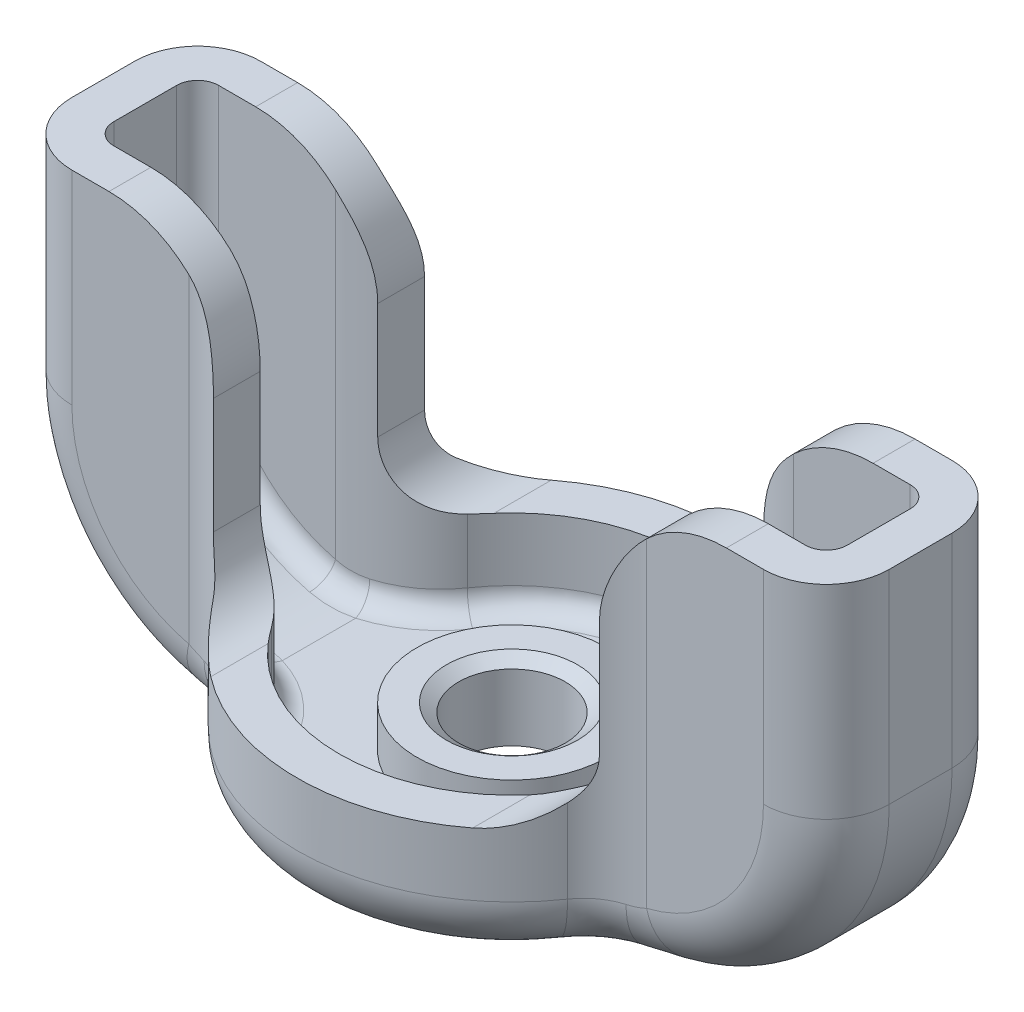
SolidWorks part; units mm, degrees
ref_plane "Front Plane" through (0, 0, 0) normal (0, 0, 1) x (1, 0, 0)
ref_plane "Top Plane" through (0, 0, 0) normal (0, 1, 0) x (1, 0, 0)
ref_plane "Right Plane" through (0, 0, 0) normal (1, 0, 0) x (0, 0, -1)
sketch "WingSke" plane through (0, 0, 0) normal (0, 1, 0) x (1, 0, 0)
  line L0 (4.6784, 2.286) -> (9.906, 2.286)
  line L1 (-9.906, 2.286) -> (-4.6784, 2.286)
  line L2 (-9.906, 2.286) -> (-9.906, -2.286)
  line L3 (-9.906, -2.286) -> (-4.6784, -2.286)
  line L4 (9.906, 2.286) -> (9.906, -2.286)
  line L5 (-9.906, 2.286) -> (9.906, -2.286) construction
  line L6 (-9.906, -2.286) -> (9.906, 2.286) construction
  line L7 (4.6784, -2.286) -> (9.906, -2.286)
  line L8 (-3.175, 4.127) -> (-3.175, -4.127) construction
  line L9 (3.175, -4.127) -> (3.175, 4.127) construction
  arc A2 (4.6784, 2.286) -> (-4.6784, 2.286) centre (0, 0) ccw
  circle A3 centre (0, 0) radius 4.191 construction
  arc A4 (-4.6784, -2.286) -> (4.6784, -2.286) centre (0, 0) ccw
  circle A5 centre (0, 0) radius 1.2891
extrude "Wing" add sketch "WingSke" along normal blind 10.16
sketch "WallSke" plane through (0, 0, 0) normal (0, 0, 1) x (1, 0, 0)
  line L0 (4.6784, 10.16) -> (-4.6784, 10.16) construction
  line L1 (-7.4827, 10.16) -> (7.4827, 10.16)
  line L2 (-4.6784, 7.3557) -> (-4.6784, 4.5514)
  line L3 (-3.175, 3.048) -> (3.175, 3.048)
  line L4 (4.6784, 7.3557) -> (4.6784, 4.5514)
  line L6 (-4.6784, 0) -> (-4.6784, -2.54)
  line L7 (-4.6784, -2.54) -> (-9.906, -2.54)
  line L8 (-9.906, -2.54) -> (-9.906, 5.2276)
  line L9 (-9.906, 10.16) -> (-9.906, 0) construction
  line L10 (-9.906, 0) -> (-4.6784, 0) construction
  line L11 (4.6784, 0) -> (4.6784, -2.54)
  line L12 (4.6784, -2.54) -> (9.906, -2.54)
  line L13 (9.906, -2.54) -> (9.906, 5.2276)
  line L14 (9.906, 10.16) -> (9.906, 0) construction
  line L15 (4.6784, 0) -> (9.906, 0) construction
  line L16 (-9.906, 10.16) -> (-4.6784, 10.16) construction
  line L17 (4.6784, 10.16) -> (9.906, 10.16) construction
  line L18 (4.6784, 7.3557) -> (4.6784, 10.16) construction
  line L19 (-4.6784, 10.16) -> (-4.6784, 0) construction
  arc A0 (-9.906, 5.2276) -> (-4.6784, 0) centre (-4.6784, 5.2276) ccw
  arc A1 (9.906, 5.2276) -> (4.6784, 0) centre (4.6784, 5.2276) cw
  arc A2 (-4.6784, 7.3557) -> (-7.4827, 10.16) centre (-7.4827, 7.3557) ccw
  arc A3 (4.6784, 7.3557) -> (7.4827, 10.16) centre (7.4827, 7.3557) cw
  arc A4 (3.175, 3.048) -> (4.6784, 4.5514) centre (3.175, 4.5514) ccw
  arc A5 (-4.6784, 4.5514) -> (-3.175, 3.048) centre (-3.175, 4.5514) ccw
  point P6 (0, 3.048)
  dimension "D1" = 2.54
  dimension "WallHeightH" = 3.048
fillet "Fillet5" radius 1.524 4 edges at (4.6784, 5.08, -2.286) (-4.6784, 5.08, -2.286) (4.6784, 5.08, 2.286) (-4.6784, 5.08, 2.286)
extrude "Wall" cut sketch "WallSke" against normal through all both and the other way through all
fillet "Fillet4" radius 1.524 18 edges at (-8.6708, 1.8529, 2.286) (-9.906, 7.6938, 2.286) (8.6708, 1.8529, -2.286) (8.6708, 1.8529, 2.286) (-8.6708, 1.8529, -2.286) (0, 0, -5.207) (0, 0, 5.207) (9.906, 7.6938, -2.286) (9.906, 7.6938, 2.286) (-9.906, 7.6938, -2.286) (5.062, 0.0141, -2.3659) (4.4679, 0, -2.7358) (-4.4679, 0, -2.7358) (-5.1266, 0.0193, -2.3457) (5.1266, 0.0193, 2.3457) (4.4679, 0, 2.7358) (-4.4679, 0, 2.7358) (-5.062, 0.0141, 2.3659)
shell "WingShell" thickness 1.016
sketch "ChamferSke" plane through (0, 0, 0) normal (0, 0, 1) x (1, 0, 0)
  line L0 (1.2891, 1.823) -> (1.5875, 2.032)
  line L1 (1.5875, 2.032) -> (2.3051, 2.032)
  line L2 (2.3051, 2.032) -> (2.3051, 3.048)
  line L3 (2.3051, 3.048) -> (1.2891, 3.048)
  line L4 (1.2891, 3.048) -> (1.2891, 1.823)
  line L5 (1.2891, 0.209) -> (1.5875, 0)
  line L6 (-3.0362, 0) -> (3.0362, 0) construction
  line L7 (1.5875, 0) -> (1.2891, 0)
  line L8 (1.2891, 0) -> (1.2891, 0.209)
  line L9 (0, 0) -> (0, 3.048) construction
  line L10 (3.175, 3.048) -> (-3.175, 3.048) construction
  line L11 (2.3051, 1.016) -> (2.3051, 3.048) construction
  line L12 (2.3051, 3.048) -> (-2.3051, 3.048) construction
revolve "Chamfers" cut sketch "ChamferSke" angle 360 about L9
sketch "ThdSchSke" plane through (0, 0, 0) normal (0, 0, 1) x (1, 0, 0)
  line L0 (0, 0) -> (0, 2.032) construction
  line L2 (-0.6445, 2.2156) -> (-0.6445, 1.7976)
  line L3 (-0.6445, 1.7976) -> (-1.2891, 1.7976)
  line L4 (-1.2891, 1.7976) -> (-1.5875, 2.0066)
  line L5 (-1.5875, 2.0066) -> (-1.2891, 2.2156)
  line L6 (-1.2891, 2.2156) -> (-0.6445, 2.2156)
  line L7 (0, 1.4783) -> (1.8294, 1.4783) construction
  line L8 (2.3051, 2.032) -> (-2.305, 2.032) construction
  line L9 (1.5875, 2.032) -> (-1.5875, 2.032) construction
revolve "ThreadSchematic" [suppressed] cut sketch "ThdSchSke" angle 360 about L0
pattern_linear "ThdSchPat" [suppressed] count 5 spacing 0.5017
equation "\"D1@Fillet4\"=\"WingThicknessC@WingSke\"/3"
equation "\"D1@Fillet5\"=\"WingThicknessC@WingSke\"/3"
equation "\"D1@ChamferSke\" = \"Thread_Major@ThreadCosmetic\" * 0.5"
equation "\"D1@ThdSchPat\"=int(  (\"BossHeightG@ChamferSke\" - 0.002 ) / \"Advance@ThdSchSke\" + 0.999 )  + 1"
equation "\"Thread_major@ThdSchSke\"=\"Thread_Major@ThreadCosmetic\""
equation "\"Tap_drill@ThdSchSke\"=\"Thread_min@WingSke\""
equation "\"D1@WingShell\"=\"ThicknessT@WingSke\""
